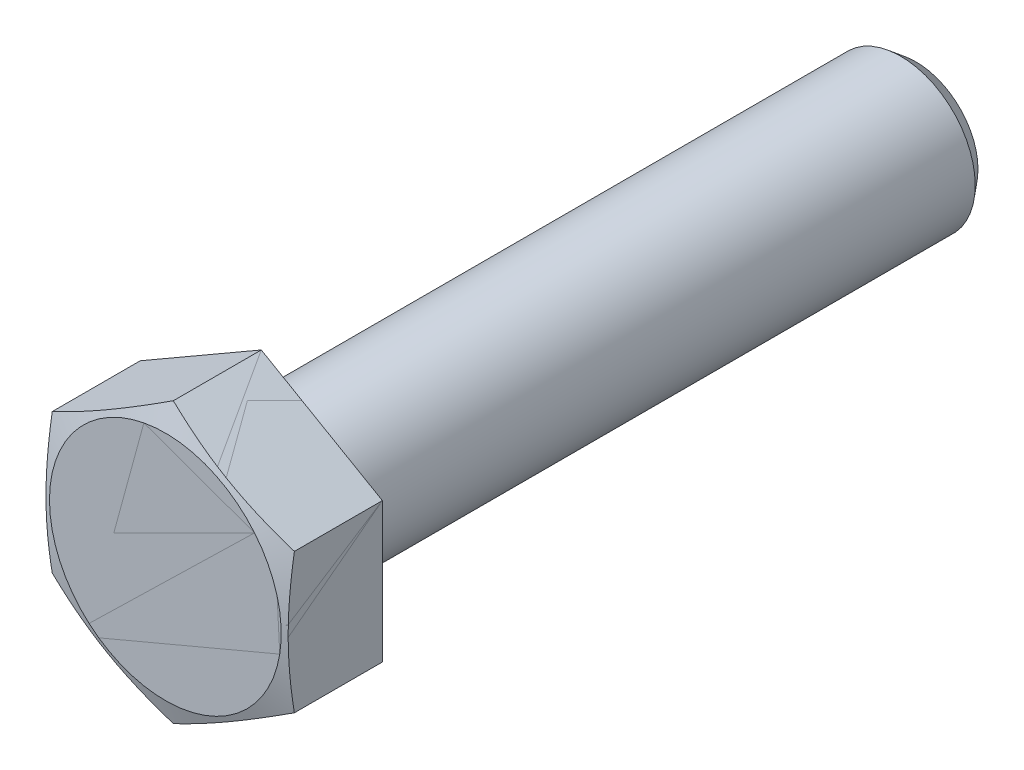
SolidWorks part; units mm, degrees
ref_plane "Face" through (0, 0, 0) normal (0, 0, 1) x (1, 0, 0)
ref_plane "Dessus" through (0, 0, 0) normal (0, 1, 0) x (1, 0, 0)
ref_plane "Droite" through (0, 0, 0) normal (1, 0, 0) x (0, 0, -1)
imported_body "Vis à métaux -- M8x35 - 6,8"
sketch "Esquisse1" plane through (0, 0, -2.544) normal (0, 0, 1) x (1, 0, 0)
  circle A0 centre (0, 0) radius 4 construction
  circle A1 centre (0, 0) radius 4
extrude "Boss.-Extru.1" add sketch "Esquisse1" along normal up to next
